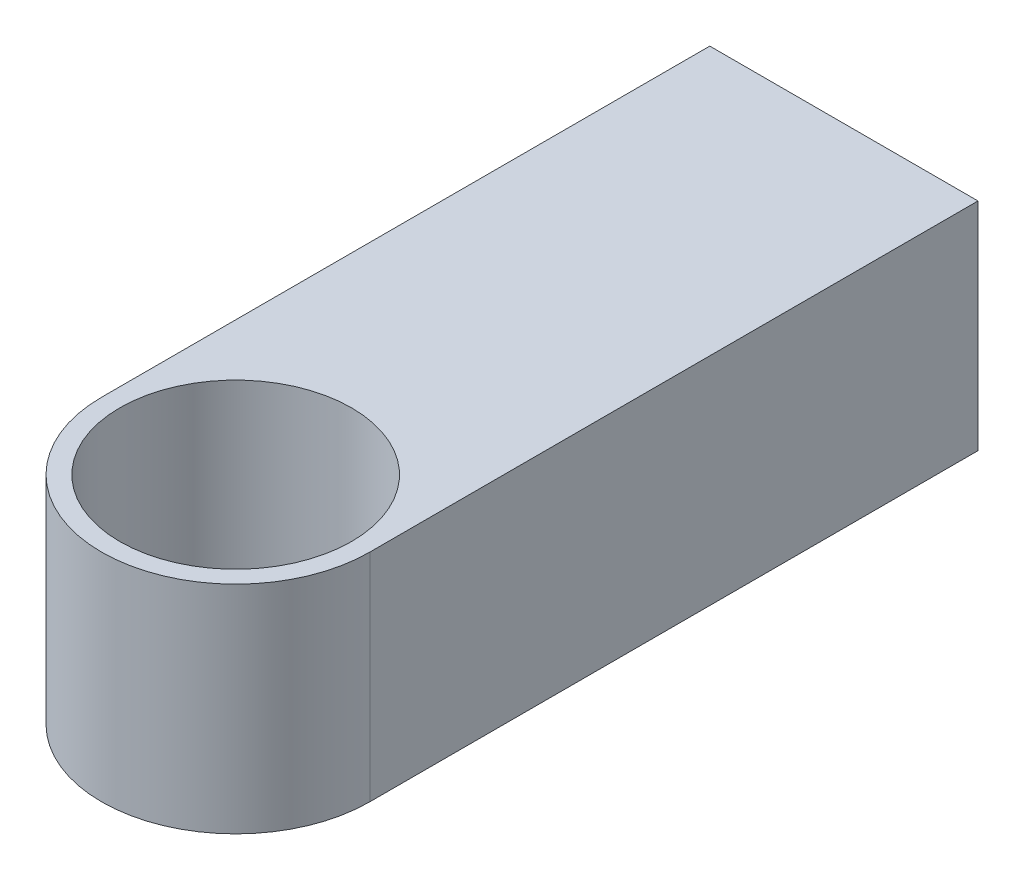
SolidWorks part; units mm, degrees
ref_plane "Front Plane" through (0, 0, 0) normal (0, 0, 1) x (1, 0, 0)
ref_plane "Top Plane" through (0, 0, 0) normal (0, 1, 0) x (1, 0, 0)
ref_plane "Right Plane" through (0, 0, 0) normal (1, 0, 0) x (0, 0, -1)
sketch "Sketch1" plane through (0, 0, 0) normal (0, 0, 1) x (1, 0, 0)
  line L0 (0, 0) -> (22.05, 0)
  line L1 (22.05, 0) -> (22.05, 35.56)
  line L9 (3, 3) -> (19.05, 3)
  line L10 (19.05, 3) -> (19.05, 35.56)
  line L12 (3, 3) -> (0, 3)
  line L13 (0, 3) -> (0, 0) construction
  line L14 (3, 35.56) -> (3, 3) construction
  line L15 (0, 35.56) -> (0, 3) construction
  line L16 (0, 38.56) -> (0, 0) construction
  line L17 (19.05, 35.56) -> (22.05, 35.56)
  line L18 (-19.05, 35.56) -> (-22.05, 35.56) construction
  line L19 (22.05, 38.56) -> (0, 38.56) construction
  line L20 (19.05, 35.56) -> (3, 35.56) construction
  line L21 (22.05, 0) -> (22.05, 38.56) construction
  line L22 (-19.05, 3) -> (-19.05, 35.56) construction
  line L23 (-3, 3) -> (-19.05, 3) construction
  line L24 (-22.05, 0) -> (-22.05, 35.56) construction
  line L25 (0, 0) -> (-22.05, 0) construction
  line L26 (-3, 3) -> (0, 3) construction
  line L27 (0, 3) -> (0, 0)
  dimension "D1" = 38.1
  dimension "D2" = 35.56
  dimension "D3" = 3
revolve "Revolve2" add sketch "Sketch1" angle 360 about L15
sketch "Sketch3" plane through (0, 0, 0) normal (0, -1, 0) x (1, 0, 0)
  circle A0 centre (0, 0) radius 5
  circle A1 centre (0, 0) radius 12.62
  dimension "D1" = 10
  dimension "D2" = 7.62
ref_plane "Plane1" through (0, 17.78, 0) normal (0, -1, 0) x (-1, 0, 0)
sketch "Sketch5" plane through (0, 17.78, 0) normal (0, -1, 0) x (-1, 0, 0)
  line L0 (0, -1000) -> (0, 49000) construction
  line L2 (-22.05, 0) -> (22.05, 0) construction
  line L9 (-22.05, 0) -> (22.05, 0) construction
  line L10 (22.05, 0) -> (22.05, 100)
  line L11 (22.05, 100) -> (-22.05, 100)
  line L12 (-22.05, 100) -> (-22.05, 0)
  arc A1 (22.05, 0) -> (-22.05, 0) centre (0, 0) ccw
  circle A3 centre (0, 0) radius 22.05 construction
extrude "Boss-Extrude3" add sketch "Sketch5" along normal up to surface and the other way up to surface
equation "\"EncoderOuterDiameter\"=1.5"
equation "\"ShaftDiameter\"= 12mm"
equation "\"PendulumDiameter\"=12mm"
equation "\"EncoderShaftDiameter\"= 6mm"
equation "\"EncoderShaftLength\"=15mm+.5in+3mm"
equation "\"ShaftHeightFromTSlot\"= 100mm"
equation "\"D1@Sketch5\"=\"ShaftHeightFromTSlot\""
